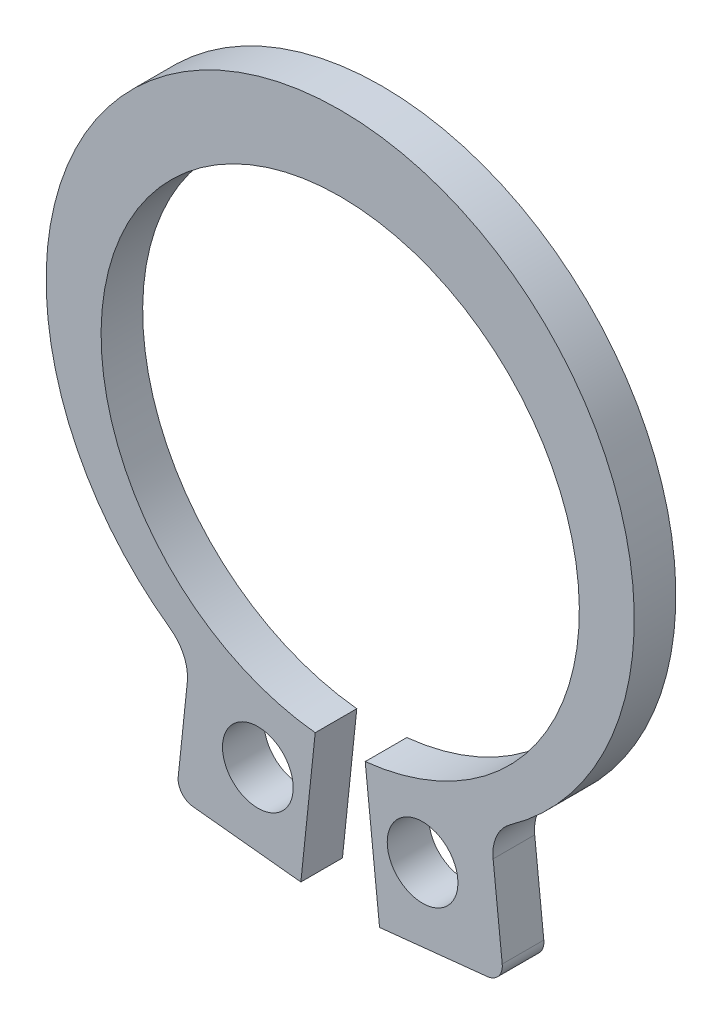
SolidWorks part; units mm, degrees
ref_plane "Face" through (0, 0, 0) normal (0, 0, 1) x (1, 0, 0)
ref_plane "Dessus" through (0, 0, 0) normal (0, 1, 0) x (1, 0, 0)
ref_plane "Droite" through (0, 0, 0) normal (1, 0, 0) x (0, 0, -1)
sketch "Esquisse1" plane through (0, 0, 0) normal (0, 0, 1) x (1, 0, 0)
  line L0 (-0.601, -5.7185) -> (-0.946, -9.0004)
  line L1 (-0.946, -9.0004) -> (-3.5397, -8.7278)
  line L2 (-3.8957, -8.2882) -> (-3.6769, -6.2071)
  line L3 (3.6769, -6.2071) -> (3.8957, -8.2882)
  line L4 (3.5397, -8.7278) -> (0.946, -9.0004)
  line L5 (0.946, -9.0004) -> (0.601, -5.7185)
  arc A0 (0.601, -5.7185) -> (-0.601, -5.7185) centre (0, 0) ccw
  arc A1 (-3.5397, -8.7278) -> (-3.8957, -8.2882) centre (-3.4978, -8.33) cw
  arc A2 (-3.6769, -6.2071) -> (-4.0926, -5.2871) centre (-4.6714, -6.1025) ccw
  arc A3 (-4.0926, -5.2871) -> (4.0926, -5.2871) centre (0, 0.4791) cw
  arc A4 (4.0926, -5.2871) -> (3.6769, -6.2071) centre (4.6714, -6.1025) ccw
  arc A5 (3.8957, -8.2882) -> (3.5397, -8.7278) centre (3.4978, -8.33) cw
extrude "Base-Extrusion" add sketch "Esquisse1" along normal blind 1
sketch "Esquisse2" plane through (0, 0, 0) normal (0, 0, 1) x (1, 0, 0)
  arc A0 (2.8304, -7.1301) -> (1.1304, -7.1301) centre (1.9804, -7.1301) cw
  arc A1 (1.1304, -7.1301) -> (2.8304, -7.1301) centre (1.9804, -7.1301) cw
extrude "Enlèv. mat.-Extru.1" cut sketch "Esquisse2" along normal blind 1
sketch "Esquisse3" plane through (0, 0, 0) normal (0, 0, 1) x (1, 0, 0)
  arc A0 (-2.8304, -7.1301) -> (-1.1304, -7.1301) centre (-1.9804, -7.1301) cw
  arc A1 (-1.1304, -7.1301) -> (-2.8304, -7.1301) centre (-1.9804, -7.1301) cw
extrude "Enlèv. mat.-Extru.2" cut sketch "Esquisse3" along normal blind 1
